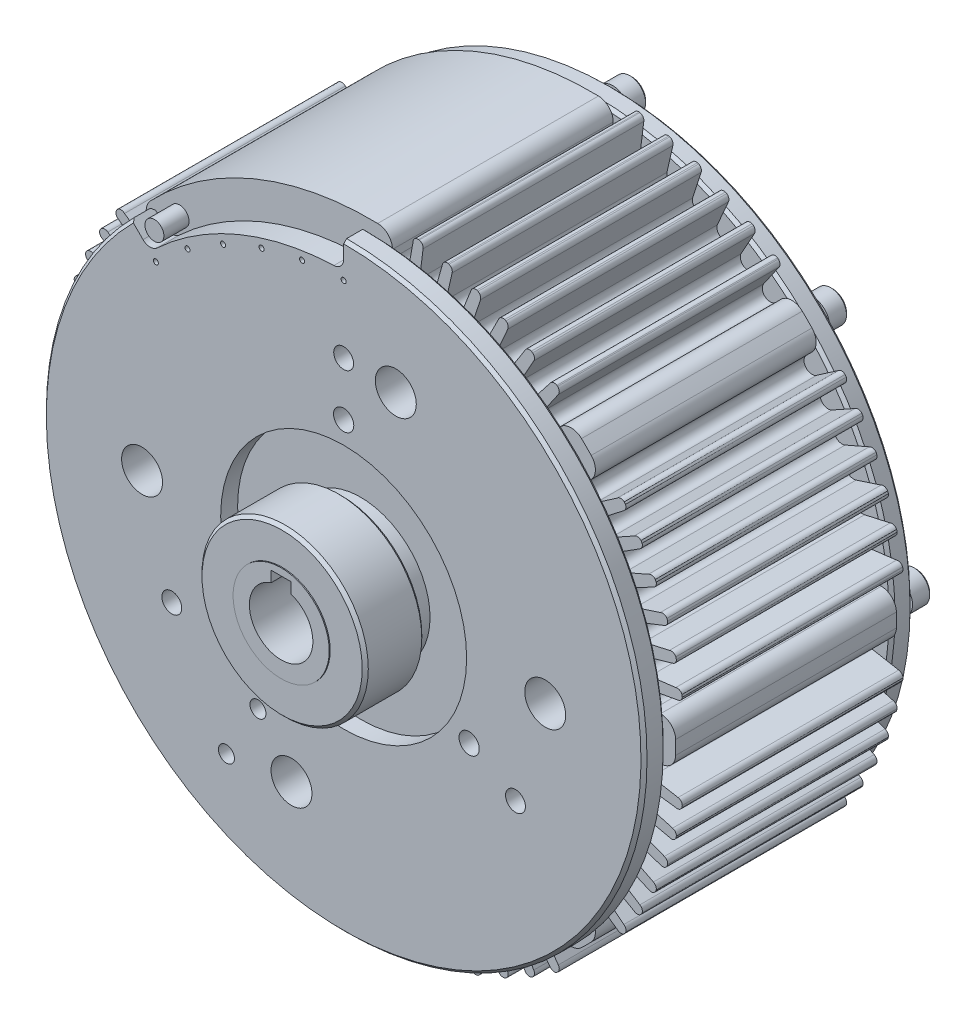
SolidWorks part; units mm, degrees
ref_plane "Front Plane" through (0, 0, 0) normal (0, 0, 1) x (1, 0, 0)
ref_plane "Top Plane" through (0, 0, 0) normal (0, 1, 0) x (1, 0, 0)
ref_plane "Right Plane" through (0, 0, 0) normal (1, 0, 0) x (0, 0, -1)
sketch "Sketch1" plane through (0, 0, 0) normal (1, 0, 0) x (0, 0, -1)
  line L0 (-15.7542, 8) -> (-15.7542, 12.109)
  line L1 (-15.7542, 12.109) -> (-15.506, 12.109)
  line L4 (-15.506, 12.109) -> (-15.506, 20.193)
  line L5 (-15.506, 20.193) -> (-14.744, 20.955)
  line L6 (-14.744, 20.955) -> (-1.268, 20.955)
  line L7 (-1.268, 20.955) -> (-0.506, 20.193)
  line L8 (-0.506, 20.193) -> (-0.506, 17.505)
  line L9 (-0.506, 17.505) -> (4.2672, 17.505)
  line L12 (-15.7542, 8) -> (88.8938, 8)
  line L14 (4.2672, 17.505) -> (4.2672, 30.9918)
  line L16 (4.2672, 30.9918) -> (0, 30.9918)
  line L18 (0, 30.9918) -> (0, 74.93)
  line L20 (0, 74.93) -> (0.762, 75.692)
  line L22 (0.762, 75.692) -> (4.826, 75.692)
  line L24 (4.826, 75.692) -> (5.588, 74.93)
  line L26 (5.588, 74.93) -> (5.588, 66.6115)
  line L28 (5.588, 66.6115) -> (6.848, 66.6115)
  line L30 (6.848, 66.6115) -> (6.848, 79.375)
  line L32 (6.848, 79.375) -> (62.474, 79.375)
  line L34 (62.474, 79.375) -> (62.474, 74.93)
  line L37 (62.474, 74.93) -> (63.236, 75.692)
  line L39 (63.236, 75.692) -> (67.046, 75.692)
  line L41 (67.046, 75.692) -> (67.808, 74.93)
  line L43 (67.808, 74.93) -> (67.808, 66.548)
  line L45 (67.808, 66.548) -> (71.872, 66.548)
  line L47 (71.872, 66.548) -> (72.634, 65.786)
  line L49 (72.634, 65.786) -> (72.634, 31.0007)
  line L51 (72.634, 31.0007) -> (75.652, 31.0007)
  line L53 (75.652, 31.0007) -> (76.4637, 30.1891)
  line L55 (76.4637, 30.1891) -> (76.4637, 19.3477)
  line L57 (80.895, 24.1149) -> (76.9654, 20.2995)
  line L58 (80.895, 24.1149) -> (81.8649, 23.1732)
  line L59 (81.8649, 23.1732) -> (81.6075, 22.098)
  line L61 (81.6075, 22.098) -> (86.8661, 22.098)
  line L63 (88.8938, 8) -> (88.8938, 13.9784)
  line L65 (88.8938, 13.9784) -> (88.3818, 14.8672)
  line L67 (88.3818, 14.8672) -> (88.3818, 20.5823)
  line L69 (-38.0952, 0) -> (104.0858, 0) construction
  arc A0 (76.9654, 20.2995) -> (76.4637, 19.3477) centre (78.178, 19.0522) ccw
  arc A1 (86.8661, 22.098) -> (88.3818, 20.5823) centre (86.8661, 20.5823) cw
  dimension "D1" = 158.75
  dimension "D2" = 62.0014
  dimension "D3" = 44.196
  dimension "D4" = 16
  dimension "D5" = 151.384
  dimension "D6" = 133.096
  dimension "D7" = 41.91
  dimension "D8" = 104.648
revolve "Revolve1" add sketch "Sketch1" angle 360 about L69
sketch "Sketch2" plane through (0, 0, -88.8938) normal (0, 0, -1) x (-1, 0, 0)
  line L0 (0, 0) -> (0, 79.375) construction
  line L1 (-2.5019, 10.3134) -> (2.5019, 10.3134)
  line L2 (-2.5019, 10.3134) -> (-2.5019, 3.81)
  line L3 (-2.5019, 3.81) -> (2.5019, 3.81)
  line L4 (2.5019, 10.3134) -> (2.5019, 3.81)
  circle A0 centre (0, 0) radius 79.375 construction
  circle A2 centre (0, 0) radius 8 construction
  dimension "D1" = 5.0038
  dimension "D2" = 18.3134
  dimension "D3" = 3.81
extrude "Cut-Extrude1" cut sketch "Sketch2" against normal through all
hole_wizard "1/4-20 Tapped Hole1" positions "Sketch4" profile "Sketch3" tap size "1/4-20" standard "Ansi Inch"
sketch "Sketch4" plane through (0, 0, -72.634) normal (0, 0, -1) x (-1, 0, 0)
  line L0 (0, 0) -> (0, 36.5125) construction
  line L5 (0, 0) -> (31.6208, -18.2563) construction
  line L8 (0, 0) -> (-31.6208, -18.2563) construction
  circle A1 centre (0, 0) radius 36.5125
  point P0 (31.6208, -18.2563)
  point P33 (-31.6208, -18.2563)
  point P35 (0, 36.5125)
  dimension "D1" = 73.025
  dimension "D2" = 120
  dimension "D3" = 120
sketch "Sketch3" plane through (-31.6208, -18.2563, -72.634) normal (1, 0, 0) x (0, 1, 0)
  line L0 (0, 0) -> (0, 12.7098)
  line L1 (0, 12.7098) -> (2.5527, 11.176)
  line L2 (2.5527, 11.176) -> (2.5527, 0)
  line L5 (2.5527, 0) -> (0, 0)
  line L10 (0, 12.7098) -> (-2.5527, 11.176) construction
  line L11 (0, -6.35) -> (0, 107.95) construction
  dimension "Tap Drill Dia." = 5.1054
  dimension "Tap Drill Depth" = 11.176
  dimension "Drill Angle" = 118
hole_wizard "M6x1.0 Tapped Hole1" positions "Sketch6" profile "Sketch5" tap size "M6x1.0" standard "Ansi Metric"
sketch "Sketch6" plane through (0, 0, -72.634) normal (0, 0, -1) x (-1, 0, 0)
  line L0 (0, 0) -> (0, 49.9999) construction
  line L3 (0, 0) -> (43.3012, -25) construction
  line L6 (0, 0) -> (-43.3012, -25) construction
  circle A0 centre (0, 0) radius 49.9999
  point P0 (0, 49.9999)
  point P26 (-43.3012, -25)
  point P28 (43.3012, -25)
  dimension "D1" = 99.9998
  dimension "D2" = 120
  dimension "D3" = 120
sketch "Sketch5" plane through (0, 49.9999, -72.634) normal (1, 0, 0) x (0, 1, 0)
  line L0 (0, 0) -> (0, 16.4882)
  line L1 (0, 16.4882) -> (2.5, 14.986)
  line L2 (2.5, 14.986) -> (2.5, 0)
  line L5 (2.5, 0) -> (0, 0)
  line L10 (0, 16.4882) -> (-2.5, 14.986) construction
  line L11 (0, -6.35) -> (0, 107.95) construction
  dimension "Tap Drill Dia." = 5
  dimension "Tap Drill Depth" = 14.986
  dimension "Drill Angle" = 118
hole_wizard "13/32 (0.40625) Diameter Hole1" positions "Sketch8" profile "Sketch7" hole size "13/32" standard "Ansi Inch"
sketch "Sketch8" plane through (0, 0, -72.634) normal (0, 0, -1) x (-1, 0, 0)
  line L1 (-50.8, 0) -> (50.8, 0) construction
  circle A0 centre (0, 0) radius 50.8
  point P0 (50.8, 0)
  point P15 (-50.8, 0)
  dimension "D1" = 101.6
sketch "Sketch7" plane through (-50.8, 0, -72.634) normal (1, 0, 0) x (0, 1, 0)
  line L0 (0, 0) -> (0, 12.7521)
  line L1 (0, 12.7521) -> (5.1594, 9.652)
  line L2 (5.1594, 9.652) -> (5.1594, 0)
  line L5 (5.1594, 0) -> (0, 0)
  line L10 (0, 12.7521) -> (-5.1594, 9.652) construction
  line L11 (0, -6.35) -> (0, 107.95) construction
  dimension "Hole Dia." = 10.3187
  dimension "Hole Depth" = 9.652
  dimension "Drill Angle" = 118
sketch "Sketch9" plane through (0, 0, 0) normal (1, 0, 0) x (0, 0, -1)
  line L0 (41.0601, 71.5899) -> (104.2946, 71.5899) construction
  line L1 (0, 0) -> (133.1346, 0) construction
  line L2 (67.808, -74.93) -> (67.808, 74.93) construction
  line L3 (67.808, 75.5586) -> (72.126, 75.5587)
  line L4 (67.808, 75.5586) -> (67.808, 71.5899)
  line L5 (67.808, 71.5899) -> (72.634, 71.5899)
  line L6 (72.634, 75.0507) -> (72.634, 71.5899)
  line L7 (72.126, 75.5587) -> (72.634, 75.0507)
  point P8 (72.634, 75.5587)
  dimension "D1" = 71.5899
  dimension "D2" = 7.9375
  dimension "D3" = 4.826
revolve "Revolve2" add sketch "Sketch9" angle 360 about L0
pattern_circular "CirPattern1" count 8 over 360 about axis through (0, 0, 0) along (0, 0, 1) of "Revolve2"
ref_plane "Plane1" through (0, 0, -36.317) normal (0, 0, -1) x (-1, 0, 0)
mirror "Mirror1" about plane through (0, 0, -36.317) normal (0, 0, -1) of "1/4-20 Tapped Hole1", "M6x1.0 Tapped Hole1"
hole_wizard "13/32 (0.40625) Diameter Hole2" positions "Sketch11" profile "Sketch10" hole size "13/32" standard "Ansi Inch"
sketch "Sketch11" plane through (0, 0, 0) normal (0, 0, 1) x (1, 0, 0)
  line L0 (0, 0) -> (13.148, 49.069) construction
  line L2 (0, 0) -> (0, 50.8) construction
  circle A0 centre (0, 0) radius 50.8
  point P0 (-50.8, 0)
  point P1 (13.148, 49.069)
  dimension "D1" = 101.6
  dimension "D2" = 15
sketch "Sketch10" plane through (-50.8, 0, 0) normal (1, 0, 0) x (0, -1, 0)
  line L0 (0, 0) -> (0, 12.7521)
  line L1 (0, 12.7521) -> (5.1594, 9.652)
  line L2 (5.1594, 9.652) -> (5.1594, 0)
  line L5 (5.1594, 0) -> (0, 0)
  line L10 (0, 12.7521) -> (-5.1594, 9.652) construction
  line L11 (0, -6.35) -> (0, 107.95) construction
  dimension "Hole Dia." = 10.3187
  dimension "Hole Depth" = 9.652
  dimension "Drill Angle" = 118
pattern_circular "CirPattern2" count 2 over 360 about axis through (0, 0, 0) along (0, 0, 1) of "13/32 (0.40625) Diameter Hole2"
hole_wizard "#10-32 Tapped Hole1" positions "Sketch13" profile "Sketch12" tap size "#10-32" standard "Ansi Inch"
sketch "Sketch13" plane through (0, 0, 0) normal (0, 0, 1) x (1, 0, 0)
  line L0 (0, 0) -> (-79.375, 0) construction
  line L3 (0, 0) -> (0, -79.375) construction
  circle A0 centre (0, 0) radius 79.375 construction
  point P0 (-21.59, -37.3888)
  point P1 (-29.5402, -51.1556)
  dimension "D1" = 37.3888
  dimension "D2" = 51.1556
  dimension "D3" = 21.59
  dimension "D4" = 29.5402
sketch "Sketch12" plane through (-21.59, -37.3888, 0) normal (1, 0, 0) x (0, -1, 0)
  line L0 (0, 0) -> (0, 13.1513)
  line L1 (0, 13.1513) -> (2.0193, 11.938)
  line L2 (2.0193, 11.938) -> (2.0193, 0)
  line L5 (2.0193, 0) -> (0, 0)
  line L10 (0, 13.1513) -> (-2.0193, 11.938) construction
  line L11 (0, -6.35) -> (0, 107.95) construction
  dimension "Tap Drill Dia." = 4.0386
  dimension "Tap Drill Depth" = 11.938
  dimension "Drill Angle" = 118
sketch "Sketch14" plane through (0, 0, -6.848) normal (0, 0, 1) x (1, 0, 0)
  line L0 (10.6424, 77.1963) -> (9.4533, 70.7158)
  line L1 (13.1677, 77.0031) -> (12.2964, 70.0161)
  line L2 (17.9925, 75.8239) -> (16.1837, 69.4733)
  line L3 (20.4876, 75.3895) -> (18.9902, 68.7651)
  line L4 (25.1772, 73.7532) -> (22.8077, 67.8522)
  line L5 (27.6191, 73.0818) -> (25.4307, 66.3893)
  line L6 (32.1303, 71.0035) -> (29.143, 65.1148)
  line L7 (34.4966, 70.1011) -> (31.6768, 63.6492)
  line L8 (38.7879, 67.6) -> (35.2499, 62.0247)
  line L9 (41.0568, 66.475) -> (37.6316, 60.3231)
  line L10 (45.0897, 63.557) -> (41.0325, 58.3636)
  line L11 (47.2404, 62.2196) -> (43.3761, 56.6542)
  line L12 (47.785, 55.4962) -> (46.4179, 54.129)
  line L13 (55.4788, 47.7677) -> (54.0982, 46.3871)
  line L14 (62.1202, 47.0826) -> (56.7408, 43.3669)
  line L15 (63.7692, 45.1604) -> (58.2125, 40.8359)
  line L16 (66.347, 40.9149) -> (60.5774, 37.7033)
  line L17 (67.8041, 38.8435) -> (61.8585, 35.0715)
  line L18 (69.9631, 34.3704) -> (63.9124, 31.7266)
  line L19 (71.215, 32.1688) -> (64.9353, 28.9841)
  line L20 (72.9354, 27.5094) -> (66.6591, 25.4578)
  line L21 (73.9705, 25.198) -> (67.4145, 22.6298)
  line L23 (75.2364, 20.3952) -> (68.7923, 18.9546)
  line L24 (76.0452, 17.9952) -> (69.2732, 16.0672)
  line L25 (77.42, 10.6267) -> (70.7155, 9.4172)
  line L26 (76.8449, 13.0932) -> (70.2924, 12.2768)
  line L27 (73.0099, 5.4579) -> (71.0698, 5.4579)
  line L28 (73.0099, -5.4611) -> (71.0698, -5.4611)
  line L29 (77.42, -10.626) -> (70.7155, -9.4231)
  line L30 (76.8449, -13.0925) -> (70.2924, -12.2761)
  line L31 (69.2732, -16.0665) -> (76.0452, -17.9945)
  line L32 (75.2364, -20.3945) -> (68.7923, -18.9538)
  line L33 (67.4145, -22.6291) -> (73.9705, -25.1973)
  line L34 (72.9354, -27.5087) -> (66.6591, -25.4571)
  line L35 (64.9353, -28.9834) -> (71.215, -32.1681)
  line L36 (69.9631, -34.3697) -> (63.9124, -31.7259)
  line L37 (61.8585, -35.0707) -> (67.8041, -38.8427)
  line L38 (66.347, -40.9142) -> (60.5774, -37.7026)
  line L39 (58.2125, -40.8352) -> (63.7692, -45.1597)
  line L40 (62.1202, -47.0819) -> (56.7408, -43.3311)
  line L41 (55.4788, -47.7677) -> (54.0982, -46.3871)
  line L42 (47.785, -55.4962) -> (46.4179, -54.129)
  line L43 (43.3761, -56.6956) -> (47.2404, -62.2532)
  line L44 (45.0897, -63.5905) -> (41.0325, -58.3629)
  line L45 (37.6316, -60.3224) -> (41.0568, -66.4742)
  line L46 (38.7879, -67.5993) -> (35.2499, -62.024)
  line L47 (31.6768, -63.6485) -> (34.4966, -70.1004)
  line L48 (32.1303, -71.0028) -> (29.143, -65.1141)
  line L49 (25.4307, -66.3886) -> (27.6191, -73.081)
  line L50 (25.1772, -73.7525) -> (22.8077, -67.3576)
  line L51 (18.9902, -68.2705) -> (20.4876, -75.3888)
  line L52 (17.9925, -75.8231) -> (16.1837, -69.4726)
  line L53 (12.2964, -70.0154) -> (13.1677, -77.0024)
  line L54 (10.6424, -77.1956) -> (9.4533, -70.7151)
  line L55 (5.4611, -71.0794) -> (5.4611, -73.0028)
  line L56 (-5.4609, -73.0099) -> (-5.4609, -71.0794)
  line L57 (-9.3916, -70.7151) -> (-10.5808, -77.1956)
  line L58 (-13.106, -77.0024) -> (-12.2347, -70.0154)
  line L59 (-16.122, -69.4726) -> (-17.9308, -75.8231)
  line L60 (-20.4259, -75.3888) -> (-18.8493, -68.2705)
  line L61 (-22.6667, -67.3576) -> (-25.1726, -73.7525)
  line L62 (-27.4977, -73.081) -> (-25.3092, -66.3886)
  line L63 (-29.1468, -65.1141) -> (-32.1341, -71.0028)
  line L64 (-34.3653, -70.1004) -> (-31.5454, -63.6485)
  line L65 (-35.267, -62.024) -> (-38.8049, -67.5993)
  line L66 (-40.9097, -66.4742) -> (-37.5699, -60.3224)
  line L67 (-40.9709, -58.3629) -> (-45.0258, -63.5905)
  line L68 (-47.1765, -62.2532) -> (-43.2968, -56.6956)
  line L69 (-54.0982, -46.3871) -> (-55.4788, -47.7677)
  line L70 (-47.785, -55.4962) -> (-46.4179, -54.129)
  line L71 (-56.6445, -43.3311) -> (-62.0585, -47.0819)
  line L72 (-63.7075, -45.1597) -> (-58.1508, -40.8352)
  line L73 (-60.5158, -37.7026) -> (-66.2853, -40.9142)
  line L74 (-67.7424, -38.8427) -> (-61.7969, -35.0707)
  line L75 (-63.8507, -31.7259) -> (-69.9015, -34.3697)
  line L76 (-71.1534, -32.1681) -> (-64.8736, -28.9834)
  line L77 (-66.5974, -25.4571) -> (-72.8737, -27.5087)
  line L78 (-73.9089, -25.1973) -> (-67.3528, -22.6291)
  line L79 (-68.7307, -18.9538) -> (-75.1747, -20.3945)
  line L80 (-75.9836, -17.9945) -> (-69.2115, -16.0665)
  line L81 (-70.2308, -12.2761) -> (-76.7832, -13.0925)
  line L82 (-77.3583, -10.626) -> (-70.6905, -9.4231)
  line L83 (-56.6445, 43.3669) -> (-62.0585, 47.0826)
  line L84 (-63.7075, 45.1604) -> (-58.1508, 40.8359)
  line L85 (-60.5158, 37.7033) -> (-66.2853, 40.9149)
  line L86 (-67.7424, 38.8435) -> (-61.7969, 35.0715)
  line L87 (-63.8507, 31.7266) -> (-69.9015, 34.3704)
  line L88 (-71.1534, 32.1689) -> (-64.8736, 28.9841)
  line L89 (-67.3528, 22.6298) -> (-73.9089, 25.1981)
  line L90 (-72.8737, 27.5094) -> (-66.5974, 25.4578)
  line L91 (-68.7307, 18.9546) -> (-75.1747, 20.3952)
  line L92 (-75.9836, 17.9952) -> (-69.2115, 16.0672)
  line L93 (-70.2308, 12.2768) -> (-76.7832, 13.0932)
  line L94 (-70.6905, 9.4172) -> (-77.3583, 10.6267)
  line L95 (-71.0621, 5.4579) -> (-73.0131, 5.4579)
  line L96 (-71.0621, -5.4579) -> (-73.0131, -5.4579)
  line L97 (5.4611, 73.0099) -> (5.4611, 71.0794)
  line L98 (-53.9246, 46.1857) -> (-55.4788, 47.7677)
  arc A1 (1.7372, 76.8189) -> (0, 76.8385) centre (0, 0) ccw
  arc A2 (5.4611, 73.0099) -> (1.7372, 76.8189) centre (1.6511, 73.0099) ccw
  arc A3 (13.1677, 77.0031) -> (10.6424, 77.1963) centre (11.9124, 77.1963) ccw
  arc A4 (5.4611, 71.0794) -> (9.4533, 70.7158) centre (7.4572, 70.8976) ccw
  arc A5 (20.4876, 75.3895) -> (17.9925, 75.8239) centre (19.2566, 75.7021) ccw
  arc A6 (12.2964, 70.0161) -> (16.1837, 69.4733) centre (14.2779, 70.0161) ccw
  arc A7 (27.6191, 73.0818) -> (25.1772, 73.7532) centre (26.4238, 73.5109) ccw
  arc A8 (18.9902, 68.7651) -> (22.8077, 67.8522) centre (20.9627, 68.5752) ccw
  arc A9 (34.4966, 70.1011) -> (32.1303, 71.0035) centre (33.348, 70.6428) ccw
  arc A10 (25.4307, 66.3893) -> (29.143, 65.1148) centre (27.3758, 66.0112) ccw
  arc A11 (-1.7372, -76.8189) -> (0, -76.8385) centre (0, 0) ccw
  arc A12 (62.1202, -47.0819) -> (63.7692, -45.1597) centre (63.0182, -46.1839) ccw
  arc A13 (60.5774, -37.7026) -> (58.2125, -40.8352) centre (59.6137, -39.434) ccw
  arc A14 (66.347, -40.9142) -> (67.8041, -38.8427) centre (67.1548, -39.9342) ccw
  arc A15 (63.9124, -31.7259) -> (61.8585, -35.0707) centre (63.119, -33.5417) ccw
  arc A16 (69.9631, -34.3697) -> (71.215, -32.1681) centre (70.6733, -33.3168) ccw
  arc A17 (66.6591, -25.4571) -> (64.9353, -28.9834) centre (66.0434, -27.3406) ccw
  arc A18 (72.9354, -27.5087) -> (73.9705, -25.1973) centre (73.5414, -26.3926) ccw
  arc A19 (68.7923, -18.9538) -> (67.4145, -22.6291) centre (68.36, -20.8877) ccw
  arc A20 (75.2364, -20.3945) -> (76.0452, -17.9945) centre (75.7326, -19.2254) ccw
  arc A21 (70.2924, -12.2761) -> (69.2732, -16.0665) centre (70.0475, -14.2424) ccw
  arc A22 (76.8449, -13.0925) -> (77.42, -10.626) centre (77.2268, -11.8812) ccw
  arc A23 (41.0325, -58.3629) -> (37.6316, -60.3224) centre (39.4689, -59.5801) ccw
  arc A24 (45.0897, -63.5905) -> (47.2404, -62.2532) centre (46.2162, -63.0041) ccw
  arc A25 (71.0698, -5.4611) -> (70.7155, -9.4231) centre (71.0724, -7.4582) ccw
  arc A26 (73.0099, -5.4611) -> (76.8189, -1.7372) centre (73.0099, -1.6511) ccw
  arc A27 (76.8189, -1.7372) -> (76.8385, 0) centre (0, 0) ccw
  arc A28 (46.4179, -54.129) -> (43.3761, -56.6956) centre (45.0057, -55.5412) ccw
  arc A29 (54.0982, 46.3871) -> (56.7408, 43.3669) centre (55.5535, 44.9942) ccw
  arc A30 (55.4788, 47.7677) -> (55.5437, 53.0948) centre (52.792, 50.4644) ccw
  arc A31 (41.0568, 66.475) -> (38.7879, 67.6) centre (39.9654, 67.1243) ccw
  arc A32 (31.6768, 63.6492) -> (35.2499, 62.0247) centre (33.5768, 63.0864) ccw
  arc A33 (53.0962, 55.5424) -> (47.785, 55.4962) centre (50.4644, 52.7893) ccw
  arc A34 (55.5437, 53.0948) -> (53.0962, 55.5424) centre (0, 0) ccw
  arc A35 (43.3761, 56.6542) -> (46.4179, 54.129) centre (45.0057, 55.5226) ccw
  arc A36 (76.8385, 0) -> (76.8189, 1.7372) centre (0, 0) ccw
  arc A37 (76.8189, 1.7372) -> (73.0099, 5.4579) centre (73.0099, 1.6478) ccw
  arc A38 (70.7155, 9.4172) -> (71.0698, 5.4579) centre (71.0698, 7.4534) ccw
  arc A39 (47.2404, 62.2196) -> (45.0897, 63.557) centre (46.2162, 62.9706) ccw
  arc A40 (37.6316, 60.3231) -> (41.0325, 58.3636) centre (39.4689, 59.5808) ccw
  arc A41 (77.42, 10.6267) -> (76.8449, 13.0932) centre (77.2268, 11.882) ccw
  arc A42 (69.2732, 16.0672) -> (70.2924, 12.2768) centre (70.0475, 14.2432) ccw
  arc A43 (76.0452, 17.9952) -> (75.2364, 20.3952) centre (75.7326, 19.2262) ccw
  arc A44 (67.4145, 22.6298) -> (68.7923, 18.9546) centre (68.36, 20.8884) ccw
  arc A45 (73.9705, 25.198) -> (72.9354, 27.5094) centre (73.5414, 26.3933) ccw
  arc A46 (64.9353, 28.9841) -> (66.6591, 25.4578) centre (66.0434, 27.3413) ccw
  arc A47 (71.215, 32.1688) -> (69.9631, 34.3704) centre (70.6733, 33.3175) ccw
  arc A48 (61.8585, 35.0715) -> (63.9124, 31.7266) centre (63.119, 33.5424) ccw
  arc A49 (67.8041, 38.8435) -> (66.347, 40.9149) centre (67.1548, 39.9349) ccw
  arc A50 (58.2125, 40.8359) -> (60.5774, 37.7033) centre (59.6137, 39.4347) ccw
  arc A51 (63.7692, 45.1604) -> (62.1202, 47.0826) centre (63.0182, 46.1846) ccw
  arc A52 (0, 76.8385) -> (-55.5437, 53.0948) centre (0, 0) ccw
  arc A53 (-56.6445, 43.3669) -> (-53.9246, 46.1857) centre (-55.5104, 44.9942) ccw
  arc A54 (-55.5437, 53.0948) -> (-55.4788, 47.7677) centre (-52.792, 50.4644) ccw
  arc A55 (-76.8189, 1.7372) -> (-76.8385, 0) centre (0, 0) ccw
  arc A56 (-73.0131, 5.4579) -> (-76.8189, 1.7372) centre (-73.0131, 1.6511) ccw
  arc A57 (-71.0621, 5.4579) -> (-70.6905, 9.4172) centre (-71.0621, 7.455) ccw
  arc A58 (-76.7832, 13.0932) -> (-77.3583, 10.6267) centre (-77.1651, 11.882) ccw
  arc A59 (-70.2308, 12.2768) -> (-69.2115, 16.0672) centre (-69.9858, 14.2432) ccw
  arc A60 (-75.1747, 20.3952) -> (-75.9836, 17.9952) centre (-75.6709, 19.2262) ccw
  arc A61 (-76.8385, 0) -> (-76.8189, -1.7372) centre (0, 0) ccw
  arc A62 (-76.8189, -1.7372) -> (-73.0131, -5.4579) centre (-73.0131, -1.6511) ccw
  arc A63 (-70.6905, -9.4231) -> (-71.0621, -5.4579) centre (-71.0277, -7.4547) ccw
  arc A64 (-47.1765, -62.2532) -> (-45.0258, -63.5905) centre (-46.1523, -63.0041) ccw
  arc A65 (-37.5699, -60.3224) -> (-40.9709, -58.3629) centre (-39.4072, -59.5801) ccw
  arc A66 (-77.3583, -10.626) -> (-76.7832, -13.0925) centre (-77.1651, -11.8812) ccw
  arc A67 (-69.2115, -16.0665) -> (-70.2308, -12.2761) centre (-69.9858, -14.2424) ccw
  arc A68 (-75.9836, -17.9945) -> (-75.1747, -20.3945) centre (-75.6709, -19.2254) ccw
  arc A69 (-67.3528, -22.6291) -> (-68.7307, -18.9538) centre (-68.2983, -20.8877) ccw
  arc A70 (-73.9089, -25.1973) -> (-72.8737, -27.5087) centre (-73.4797, -26.3926) ccw
  arc A71 (-64.8736, -28.9834) -> (-66.5974, -25.4571) centre (-65.9817, -27.3406) ccw
  arc A72 (-71.1534, -32.1681) -> (-69.9015, -34.3697) centre (-70.6116, -33.3168) ccw
  arc A73 (-61.7969, -35.0707) -> (-63.8507, -31.7259) centre (-63.0573, -33.5417) ccw
  arc A74 (-67.7424, -38.8427) -> (-66.2853, -40.9142) centre (-67.0931, -39.9342) ccw
  arc A75 (-58.1508, -40.8352) -> (-60.5158, -37.7026) centre (-59.552, -39.434) ccw
  arc A76 (-63.7075, -45.1597) -> (-62.0585, -47.0819) centre (-62.9565, -46.1839) ccw
  arc A77 (-5.4609, -73.0099) -> (-1.7372, -76.8189) centre (-1.6509, -73.0099) ccw
  arc A78 (-13.106, -77.0024) -> (-10.5808, -77.1956) centre (-11.8508, -77.1956) ccw
  arc A79 (-5.4609, -71.0794) -> (-9.3916, -70.7151) centre (-7.4544, -71.2005) ccw
  arc A80 (-20.4259, -75.3888) -> (-17.9308, -75.8231) centre (-19.195, -75.7014) ccw
  arc A81 (-12.2347, -70.0154) -> (-16.122, -69.4726) centre (-14.2163, -70.0154) ccw
  arc A82 (-27.4977, -73.081) -> (-25.1726, -73.7525) centre (-26.3621, -73.5102) ccw
  arc A83 (-18.8493, -68.2705) -> (-22.6667, -67.3576) centre (-20.8217, -68.0806) ccw
  arc A84 (-34.3653, -70.1004) -> (-32.1341, -71.0028) centre (-33.2863, -70.6421) ccw
  arc A85 (-25.3092, -66.3886) -> (-29.1468, -65.1141) centre (-27.3141, -66.0105) ccw
  arc A86 (-40.9097, -66.4742) -> (-38.8049, -67.5993) centre (-39.9037, -67.1236) ccw
  arc A87 (-31.5454, -63.6485) -> (-35.267, -62.024) centre (-33.5151, -63.0857) ccw
  arc A88 (-54.0982, -46.3871) -> (-56.6445, -43.3311) centre (-55.5104, -44.9749) ccw
  arc A89 (-55.4788, -47.7677) -> (-55.5437, -53.0948) centre (-52.792, -50.4644) ccw
  arc A90 (-55.5437, -53.0948) -> (-53.0962, -55.5424) centre (0, 0) ccw
  arc A91 (-53.0962, -55.5424) -> (-47.785, -55.4962) centre (-50.4644, -52.7893) ccw
  arc A92 (-43.2968, -56.6956) -> (-46.4179, -54.129) centre (-44.9634, -55.5412) ccw
  arc A93 (47.785, -55.4962) -> (53.0962, -55.5424) centre (50.4644, -52.7893) ccw
  arc A94 (53.0962, -55.5424) -> (55.5437, -53.0948) centre (0, 0) ccw
  arc A95 (55.5437, -53.0948) -> (55.4788, -47.7677) centre (52.792, -50.4644) ccw
  arc A96 (56.7408, -43.3311) -> (54.0982, -46.3871) centre (55.5535, -44.9749) ccw
  arc A97 (35.2499, -62.024) -> (31.6768, -63.6485) centre (33.5768, -63.0857) ccw
  arc A98 (38.7879, -67.5993) -> (41.0568, -66.4742) centre (39.9654, -67.1236) ccw
  arc A99 (29.143, -65.1141) -> (25.4307, -66.3886) centre (27.3758, -66.0105) ccw
  arc A100 (32.1303, -71.0028) -> (34.4966, -70.1004) centre (33.348, -70.6421) ccw
  arc A101 (22.8077, -67.3576) -> (18.9902, -68.2705) centre (20.9627, -68.0806) ccw
  arc A102 (25.1772, -73.7525) -> (27.6191, -73.081) centre (26.4238, -73.5102) ccw
  arc A103 (16.1837, -69.4726) -> (12.2964, -70.0154) centre (14.2779, -70.0154) ccw
  arc A104 (17.9925, -75.8231) -> (20.4876, -75.3888) centre (19.2566, -75.7014) ccw
  arc A105 (9.4533, -70.7151) -> (5.4611, -71.0794) centre (7.4572, -70.8973) ccw
  arc A106 (10.6424, -77.1956) -> (13.1677, -77.0024) centre (11.9124, -77.1956) ccw
  arc A107 (1.7372, -76.8189) -> (5.4611, -73.0028) centre (1.6511, -73.0099) ccw
  arc A108 (0, -76.8385) -> (1.7372, -76.8189) centre (0, 0) ccw
  arc A109 (-62.0585, 47.0826) -> (-63.7075, 45.1604) centre (-62.9565, 46.1846) ccw
  arc A110 (-60.5158, 37.7033) -> (-58.1508, 40.8359) centre (-59.552, 39.4347) ccw
  arc A111 (-66.2853, 40.9149) -> (-67.7424, 38.8435) centre (-67.0931, 39.9349) ccw
  arc A112 (-63.8507, 31.7266) -> (-61.7969, 35.0715) centre (-63.0573, 33.5424) ccw
  arc A113 (-69.9015, 34.3704) -> (-71.1534, 32.1689) centre (-70.6116, 33.3175) ccw
  arc A114 (-66.5974, 25.4578) -> (-64.8736, 28.9841) centre (-65.9817, 27.3413) ccw
  arc A115 (-72.8737, 27.5094) -> (-73.9089, 25.1981) centre (-73.4797, 26.3934) ccw
  arc A116 (-68.7307, 18.9546) -> (-67.3528, 22.6298) centre (-68.2983, 20.8884) ccw
extrude "Cut-Extrude2" cut sketch "Sketch14" against normal up to surface (55.626 mm away) flip side to cut
sketch "Sketch17" plane through (0, 0, 0) normal (0, 0, 1) x (1, 0, 0)
  line L0 (0, 71.5067) -> (0, 82.1635)
  line L1 (-50.5629, 50.5629) -> (-65.2914, 65.2914)
  line L2 (-65.2914, 65.2914) -> (0, 82.1635)
  line L3 (0, 0) -> (-71.8719, 71.8719) construction
  line L4 (0, 0) -> (0, 91.2446) construction
  line L5 (0, 0) -> (-39.3399, 54.1467) construction
  line L6 (0, 0) -> (-30.3851, 59.6342) construction
  line L7 (0, 0) -> (-20.6822, 63.6533) construction
  line L8 (0, 0) -> (-10.47, 66.105) construction
  circle A0 centre (0, 0) radius 66.929 construction
  arc A1 (-2.4498, 68.9683) -> (-47.0357, 50.5002) centre (0, 0) ccw
  arc A2 (-2.4498, 68.9683) -> (0, 71.5067) centre (-2.54, 71.5067) ccw
  arc A3 (-47.0357, 50.5002) -> (-50.5629, 50.5629) centre (-48.7668, 52.3589) cw
  circle A4 centre (-47.3259, 47.3259) radius 0.635
  circle A5 centre (-39.3399, 54.1467) radius 0.635
  circle A6 centre (-30.3851, 59.6342) radius 0.635
  circle A7 centre (-20.6822, 63.6533) radius 0.635
  circle A8 centre (-10.47, 66.105) radius 0.635
  circle A9 centre (0, 66.929) radius 0.635
  dimension "D2" = 133.858
  dimension "D3" = 138.0236
  dimension "D4" = 2.54
  dimension "D1" = 1.27
  dimension "D5" = 45
  dimension "D6" = 9
  dimension "D7" = 18
  dimension "D8" = 27
  dimension "D9" = 9
extrude "Cut-Extrude6" cut sketch "Sketch17" against normal up to surface (5.588 mm away)
sketch "Sketch18" plane through (0, 0, -6.848) normal (0, 0, 1) x (1, 0, 0)
  line L0 (0, 0) -> (0, 76.8385) construction
  line L1 (0, 0) -> (-51.415, 57.1022) construction
  circle A0 centre (-48.1834, 53.5131) radius 2.3876
  arc A1 (1.7372, 76.8189) -> (-55.5437, 53.0948) centre (0, 0) ccw construction
  circle A2 centre (0, 0) radius 72.009 construction
  dimension "D1" = 4.7752
  dimension "D2" = 144.018
  dimension "D3" = 42
extrude "Boss-Extrude1" add sketch "Sketch18" along normal blind 6.35
